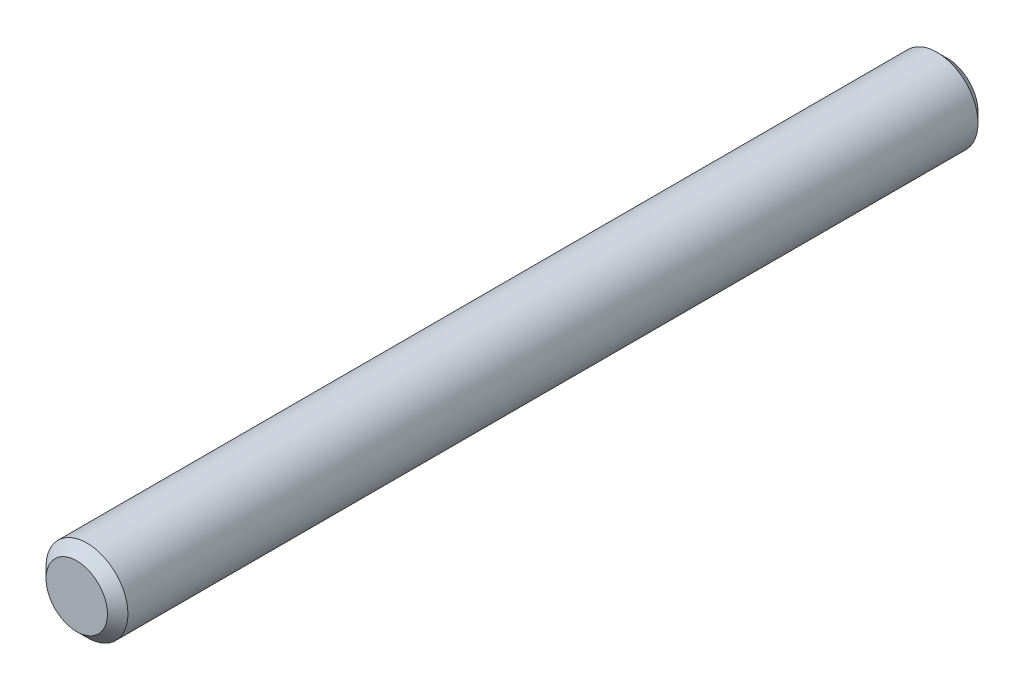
SolidWorks part; units mm, degrees
ref_plane "Face" through (0, 0, 0) normal (0, 0, 1) x (1, 0, 0)
ref_plane "Dessus" through (0, 0, 0) normal (0, 1, 0) x (1, 0, 0)
ref_plane "Droite" through (0, 0, 0) normal (1, 0, 0) x (0, 0, -1)
sketch "Esquisse1" plane through (0, 0, 0) normal (0, 0, 1) x (1, 0, 0)
  circle A0 centre (0, 0) radius 8
  dimension "D1" = 16
extrude "Extrusion1" add sketch "Esquisse1" along normal mid plane 170
chamfer "Chanfrein1" distance 2 angle 45
